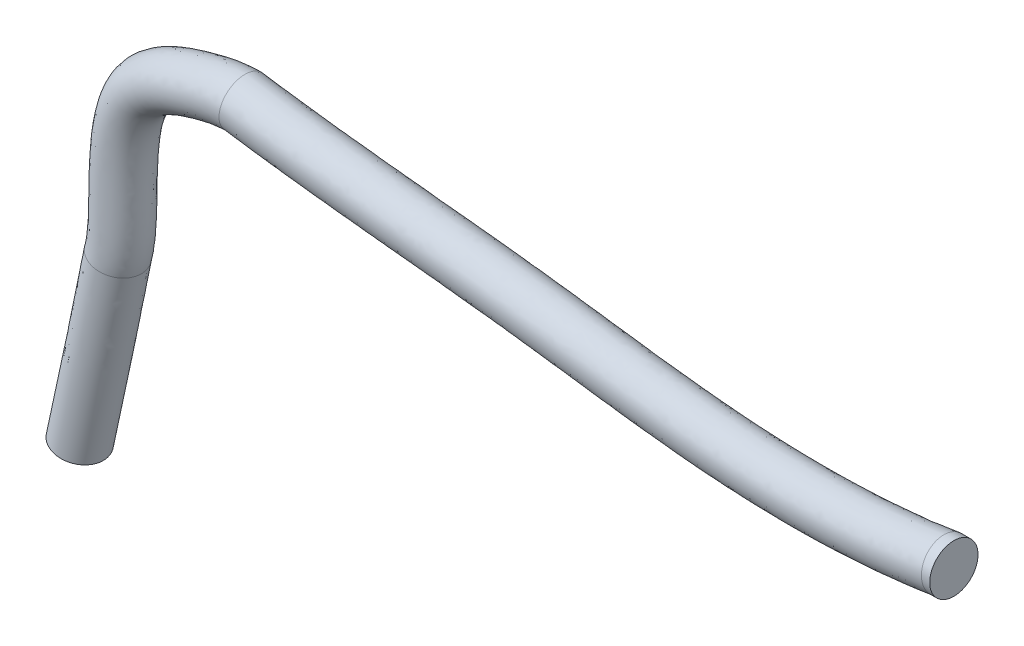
SolidWorks part; units mm, degrees
ref_plane "前视基准面" through (0, 0, 0) normal (0, 0, 1) x (1, 0, 0)
ref_plane "上视基准面" through (0, 0, 0) normal (0, 1, 0) x (1, 0, 0)
ref_plane "右视基准面" through (0, 0, 0) normal (1, 0, 0) x (0, 0, -1)
sketch "草图1" plane through (0, 0, 0) normal (0, 0, 1) x (1, 0, 0)
  spline S0 degree 3 poles (-232.8257, 16.389) (-237.2502, 16.389) (-248.1261, 13.8977) (-278.7804, 3.0789) (-270.4284, -34.4919) (-274.3773, -48.2038) knots 0 0 0 0 0.149293 0.383452 1 1 1 1
  spline S1 degree 3 poles (-232.8257, 16.389) (-200.9806, 11.5945) (-146.0969, 7.5591) (-68.9244, -4.822) (-22.7439, -3.5997) (0, 0) knots 0 0 0 0 0.412376 0.705016 1 1 1 1
  spline S2 degree 1 poles (0, 0) (2.7265, 0) knots 0 0 1 1
  spline S3 degree 2 poles (-274.3773, -48.2038) (-280.444, -78.2847) (-287.0086, -108.2594) knots 0 0 0 1 1 1
sketch "草图2" plane through (0, 0, 0) normal (1, 0, 0) x (0, 0, -1)
  circle A0 centre (0, 0) radius 8
  dimension "D1" = 16
sweep "扫描1" add profiles "草图2" path "草图1"
